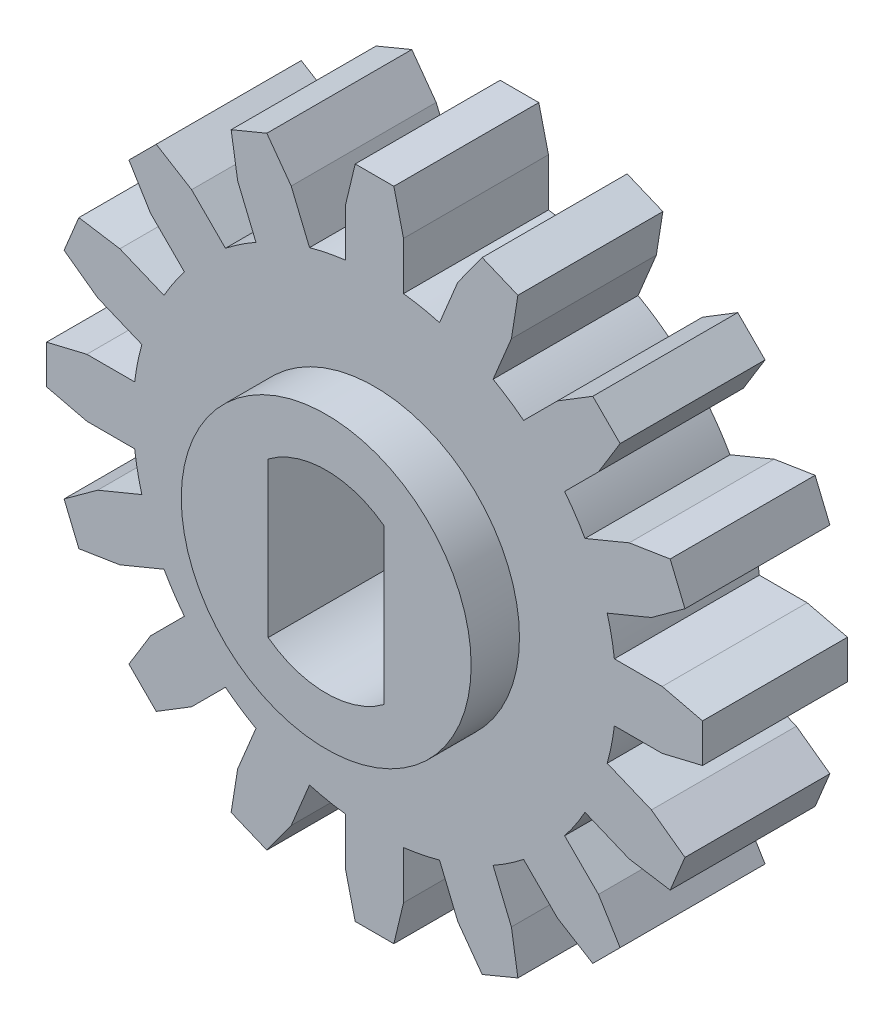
SolidWorks part; units mm, degrees
ref_plane "Front Plane" through (0, 0, 0) normal (0, 0, 1) x (1, 0, 0)
ref_plane "Top Plane" through (0, 0, 0) normal (0, 1, 0) x (1, 0, 0)
ref_plane "Right Plane" through (0, 0, 0) normal (1, 0, 0) x (0, 0, -1)
sketch "Sketch1" plane through (0, 0, 0) normal (0, 0, 1) x (1, 0, 0)
  circle A0 centre (0, 0) radius 6.35
  dimension "D1" = 12.7
extrude "Boss-Extrude1" add sketch "Sketch1" along normal blind 3.81 contours A0
sketch "Sketch3" plane through (0, 0, 3.81) normal (0, 0, 1) x (1, 0, 0)
  circle A0 centre (0, 0) radius 3.81
  dimension "D1" = 7.62
extrude "Boss-Extrude2" add sketch "Sketch3" along normal blind 1.27
sketch "Sketch4" plane through (0, 0, 0) normal (0, 0, -1) x (-1, 0, 0)
  circle A0 centre (0, 0) radius 3.81
  dimension "D1" = 7.62
extrude "Boss-Extrude3" add sketch "Sketch4" along normal blind 1.27
sketch "Sketch5" plane through (0, 0, -1.27) normal (0, 0, -1) x (-1, 0, 0)
  line L0 (-1.524, 2.032) -> (-1.524, -2.032)
  line L1 (0, 3.3202) -> (0, -3.5092) construction
  line L2 (1.524, 2.032) -> (1.524, -2.032)
  arc A0 (-1.524, -2.032) -> (1.524, -2.032) centre (0, 0) ccw
  arc A1 (1.524, 2.032) -> (-1.524, 2.032) centre (0, 0) ccw
  dimension "D1" = 5.08
  dimension "D2" = 1.524
extrude "Cut-Extrude2" cut sketch "Sketch5" against normal through all
sketch "Sketch6" plane through (0, 0, 3.81) normal (0, 0, 1) x (1, 0, 0)
  line L0 (0, 0) -> (0, 8.636) construction
  line L1 (-0.508, 8.621) -> (-0.762, 7.5612)
  line L2 (-0.762, 7.5612) -> (-0.762, 6.2912)
  line L3 (0.508, 8.621) -> (0.762, 7.5612)
  line L4 (0.762, 7.5612) -> (0.762, 6.2912)
  line L5 (-0.508, 8.621) -> (0.508, 8.621)
  line L6 (2.1895, 7.2772) -> (1.7035, 6.1039)
  line L7 (2.8298, 8.1592) -> (2.1895, 7.2772)
  line L8 (2.8298, 8.1592) -> (3.7685, 7.7704)
  line L9 (3.7685, 7.7704) -> (3.5975, 6.694)
  line L10 (3.5975, 6.694) -> (3.1115, 5.5207)
  line L11 (4.8077, 5.8854) -> (3.9097, 4.9873)
  line L12 (5.7368, 6.4552) -> (4.8077, 5.8854)
  line L13 (5.7368, 6.4552) -> (6.4552, 5.7368)
  line L14 (6.4552, 5.7368) -> (5.8854, 4.8077)
  line L15 (5.8854, 4.8077) -> (4.9873, 3.9097)
  line L16 (6.694, 3.5975) -> (5.5207, 3.1115)
  line L17 (7.7704, 3.7685) -> (6.694, 3.5975)
  line L18 (7.7704, 3.7685) -> (8.1592, 2.8298)
  line L19 (8.1592, 2.8298) -> (7.2772, 2.1895)
  line L20 (7.2772, 2.1895) -> (6.1039, 1.7035)
  line L21 (7.5612, 0.762) -> (6.2912, 0.762)
  line L22 (8.621, 0.508) -> (7.5612, 0.762)
  line L23 (8.621, 0.508) -> (8.621, -0.508)
  line L24 (8.621, -0.508) -> (7.5612, -0.762)
  line L25 (7.5612, -0.762) -> (6.2912, -0.762)
  line L26 (7.2772, -2.1895) -> (6.1039, -1.7035)
  line L27 (8.1592, -2.8298) -> (7.2772, -2.1895)
  line L28 (8.1592, -2.8298) -> (7.7704, -3.7685)
  line L29 (7.7704, -3.7685) -> (6.694, -3.5975)
  line L30 (6.694, -3.5975) -> (5.5207, -3.1115)
  line L31 (5.8854, -4.8077) -> (4.9873, -3.9097)
  line L32 (6.4552, -5.7368) -> (5.8854, -4.8077)
  line L33 (6.4552, -5.7368) -> (5.7368, -6.4552)
  line L34 (5.7368, -6.4552) -> (4.8077, -5.8854)
  line L35 (4.8077, -5.8854) -> (3.9097, -4.9873)
  line L36 (3.5975, -6.694) -> (3.1115, -5.5207)
  line L37 (3.7685, -7.7704) -> (3.5975, -6.694)
  line L38 (3.7685, -7.7704) -> (2.8298, -8.1592)
  line L39 (2.8298, -8.1592) -> (2.1895, -7.2772)
  line L40 (2.1895, -7.2772) -> (1.7035, -6.1039)
  line L41 (0.762, -7.5612) -> (0.762, -6.2912)
  line L42 (0.508, -8.621) -> (0.762, -7.5612)
  line L43 (0.508, -8.621) -> (-0.508, -8.621)
  line L44 (-0.508, -8.621) -> (-0.762, -7.5612)
  line L45 (-0.762, -7.5612) -> (-0.762, -6.2912)
  line L46 (-2.1895, -7.2772) -> (-1.7035, -6.1039)
  line L47 (-2.8298, -8.1592) -> (-2.1895, -7.2772)
  line L48 (-2.8298, -8.1592) -> (-3.7685, -7.7704)
  line L49 (-3.7685, -7.7704) -> (-3.5975, -6.694)
  line L50 (-3.5975, -6.694) -> (-3.1115, -5.5207)
  line L51 (-4.8077, -5.8854) -> (-3.9097, -4.9873)
  line L52 (-5.7368, -6.4552) -> (-4.8077, -5.8854)
  line L53 (-5.7368, -6.4552) -> (-6.4552, -5.7368)
  line L54 (-6.4552, -5.7368) -> (-5.8854, -4.8077)
  line L55 (-5.8854, -4.8077) -> (-4.9873, -3.9097)
  line L56 (-6.694, -3.5975) -> (-5.5207, -3.1115)
  line L57 (-7.7704, -3.7685) -> (-6.694, -3.5975)
  line L58 (-7.7704, -3.7685) -> (-8.1592, -2.8298)
  line L59 (-8.1592, -2.8298) -> (-7.2772, -2.1895)
  line L60 (-7.2772, -2.1895) -> (-6.1039, -1.7035)
  line L61 (-7.5612, -0.762) -> (-6.2912, -0.762)
  line L62 (-8.621, -0.508) -> (-7.5612, -0.762)
  line L63 (-8.621, -0.508) -> (-8.621, 0.508)
  line L64 (-8.621, 0.508) -> (-7.5612, 0.762)
  line L65 (-7.5612, 0.762) -> (-6.2912, 0.762)
  line L66 (-7.2772, 2.1895) -> (-6.1039, 1.7035)
  line L67 (-8.1592, 2.8298) -> (-7.2772, 2.1895)
  line L68 (-8.1592, 2.8298) -> (-7.7704, 3.7685)
  line L69 (-7.7704, 3.7685) -> (-6.694, 3.5975)
  line L70 (-6.694, 3.5975) -> (-5.5207, 3.1115)
  line L71 (-5.8854, 4.8077) -> (-4.9873, 3.9097)
  line L72 (-6.4552, 5.7368) -> (-5.8854, 4.8077)
  line L73 (-6.4552, 5.7368) -> (-5.7368, 6.4552)
  line L74 (-5.7368, 6.4552) -> (-4.8077, 5.8854)
  line L75 (-4.8077, 5.8854) -> (-3.9097, 4.9873)
  line L76 (-3.5975, 6.694) -> (-3.1115, 5.5207)
  line L77 (-3.7685, 7.7704) -> (-3.5975, 6.694)
  line L78 (-3.7685, 7.7704) -> (-2.8298, 8.1592)
  line L79 (-2.8298, 8.1592) -> (-2.1895, 7.2772)
  line L80 (-2.1895, 7.2772) -> (-1.7035, 6.1039)
  circle A0 centre (0, 0) radius 8.636 construction
  arc A1 (3.1115, 5.5207) -> (1.7035, 6.1039) centre (0, 0) ccw
  arc A2 (0.762, 6.2912) -> (-0.762, 6.2912) centre (0, 0) ccw
  arc A3 (4.9873, 3.9097) -> (3.9097, 4.9873) centre (0, 0) ccw
  arc A4 (6.1039, 1.7035) -> (5.5207, 3.1115) centre (0, 0) ccw
  arc A5 (6.2912, -0.762) -> (6.2912, 0.762) centre (0, 0) ccw
  arc A6 (5.5207, -3.1115) -> (6.1039, -1.7035) centre (0, 0) ccw
  arc A7 (3.9097, -4.9873) -> (4.9873, -3.9097) centre (0, 0) ccw
  arc A8 (1.7035, -6.1039) -> (3.1115, -5.5207) centre (0, 0) ccw
  arc A9 (-0.762, -6.2912) -> (0.762, -6.2912) centre (0, 0) ccw
  arc A10 (-3.1115, -5.5207) -> (-1.7035, -6.1039) centre (0, 0) ccw
  arc A11 (-4.9873, -3.9097) -> (-3.9097, -4.9873) centre (0, 0) ccw
  arc A12 (-6.1039, -1.7035) -> (-5.5207, -3.1115) centre (0, 0) ccw
  arc A13 (-6.2912, 0.762) -> (-6.2912, -0.762) centre (0, 0) ccw
  arc A14 (-5.5207, 3.1115) -> (-6.1039, 1.7035) centre (0, 0) ccw
  arc A15 (-3.9097, 4.9873) -> (-4.9873, 3.9097) centre (0, 0) ccw
  arc A16 (-1.7035, 6.1039) -> (-3.1115, 5.5207) centre (0, 0) ccw
  point P103 (0, 0)
  dimension "D1" = 17.272
  dimension "D2" = 0.762
  dimension "D3" = 0.508
  dimension "D4" = 1.27
  dimension "D5" = 16
extrude "Boss-Extrude4" add sketch "Sketch6" against normal blind 3.81
